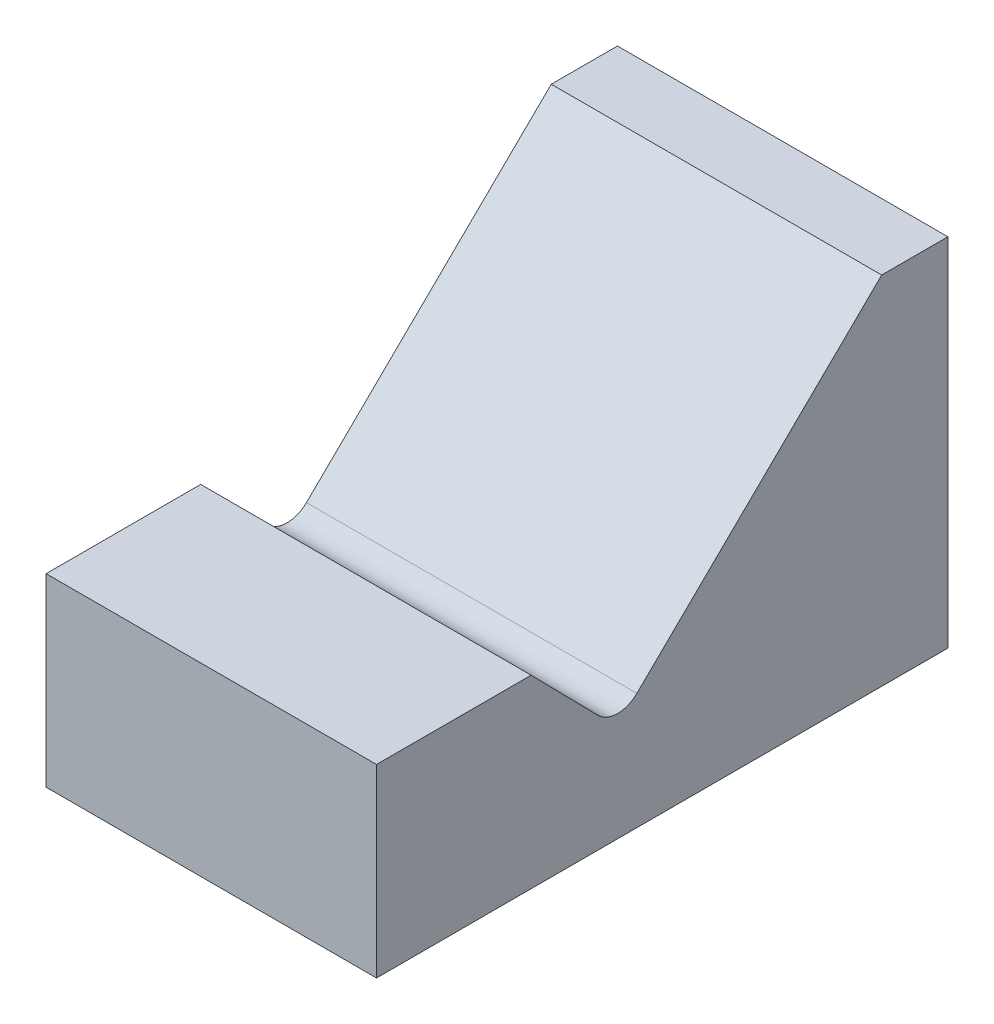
SolidWorks part; units mm, degrees
ref_plane "Front Plane" through (0, 0, 0) normal (0, 0, 1) x (1, 0, 0)
ref_plane "Top Plane" through (0, 0, 0) normal (0, 1, 0) x (1, 0, 0)
ref_plane "Right Plane" through (0, 0, 0) normal (1, 0, 0) x (0, 0, -1)
sketch "Sketch1" plane through (0, 0, 0) normal (1, 0, 0) x (0, 0, -1)
  line L0 (0, 84.6719) -> (0, -79.6202)
  line L1 (-161.3974, -25.7772) -> (-192.217, 5.6762)
  line L2 (-192.217, 5.6762) -> (-263.5146, 5.6762)
  line L3 (-263.5146, 5.6762) -> (-263.5146, -79.6202)
  line L5 (-30.5302, 84.6719) -> (0, 84.6719)
  line L6 (-143.4378, -25.9601) -> (-30.5302, 84.6719)
  line L8 (0, -79.6202) -> (-263.5146, -79.6202)
  arc A0 (-161.3974, -25.7772) -> (-143.4378, -25.9601) centre (-152.3262, -16.8889) ccw
  dimension "D1" = 12.7
extrude "Boss-Extrude1" add sketch "Sketch1" along normal mid plane 152.4 contours L6 L5 L0 L8 L3 L2 L1 A0
